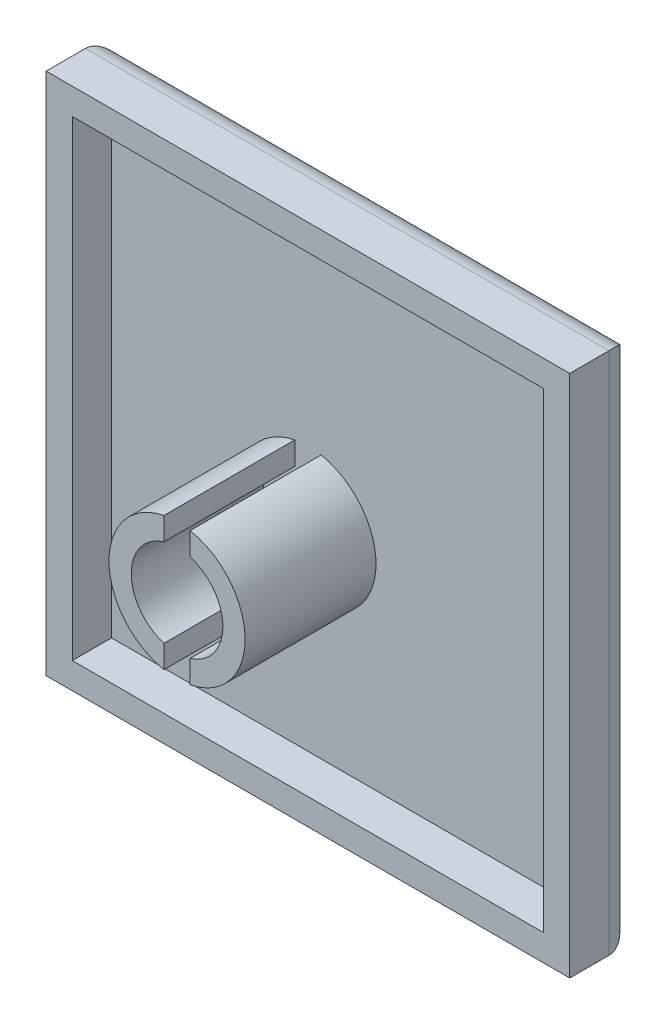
SolidWorks part; units mm, degrees
ref_plane "前视基准面" through (0, 0, 0) normal (0, 0, 1) x (1, 0, 0)
ref_plane "上视基准面" through (0, 0, 0) normal (0, 1, 0) x (1, 0, 0)
ref_plane "右视基准面" through (0, 0, 0) normal (1, 0, 0) x (0, 0, -1)
sketch "草图1" plane through (0, 0, 0) normal (0, 0, 1) x (1, 0, 0)
  line L1 (-10, 10) -> (10, 10)
  line L2 (-10, 10) -> (-10, -10)
  line L3 (-10, -10) -> (10, -10)
  line L4 (10, 10) -> (10, -10)
  dimension "D1" = 20
  dimension "D2" = 20
extrude "凸台-拉伸1" add sketch "草图1" along normal mid plane 2.5
fillet "圆角1" radius 1 4 edges at (0, -10, -1.25) (-10, 0, -1.25) (0, 10, -1.25) (10, 0, -1.25)
sketch "草图2" plane through (0, 0, 1.25) normal (0, 0, 1) x (1, 0, 0)
  circle A0 centre (0, 0) radius 2.6
extrude "凸台-拉伸2" add sketch "草图2" along normal blind 5
sketch "草图3" plane through (0, 0, 1.25) normal (0, 0, 1) x (1, 0, 0)
  line L0 (10, 10) -> (-10, 10) construction
  line L1 (-9, 9) -> (9, 9)
  line L2 (-9, 9) -> (-9, -9)
  line L3 (-9, -9) -> (9, -9)
  line L4 (9, 9) -> (9, -9)
  line L5 (-10, 10) -> (-10, -10) construction
  dimension "D1" = 18
  dimension "D2" = 18
  dimension "D3" = 1
  dimension "D4" = 1
extrude "切除-拉伸2" cut sketch "草图3" against normal blind 1.5
sketch "草图4" plane through (0, 0, 6.25) normal (0, 0, 1) x (1, 0, 0)
  circle A0 centre (0, 0) radius 1.75
extrude "切除-拉伸3" cut sketch "草图4" against normal offset from surface (5 mm away) 1.5
sketch "草图5" plane through (0, -10, 0) normal (0, -1, 0) x (1, 0, 0)
  line L0 (1.75, 6.25) -> (-1.75, 6.25) construction
  line L1 (-0.5, 6.25) -> (0.5, 6.25)
  line L2 (-0.5, 6.25) -> (-0.5, 1.25)
  line L3 (-0.5, 1.25) -> (0.5, 1.25)
  line L4 (0.5, 6.25) -> (0.5, 1.25)
  line L5 (-10, 1.25) -> (10, 1.25) construction
  dimension "D1" = 1
  dimension "D2" = 0.5
extrude "切除-拉伸4" cut sketch "草图5" against normal through all
